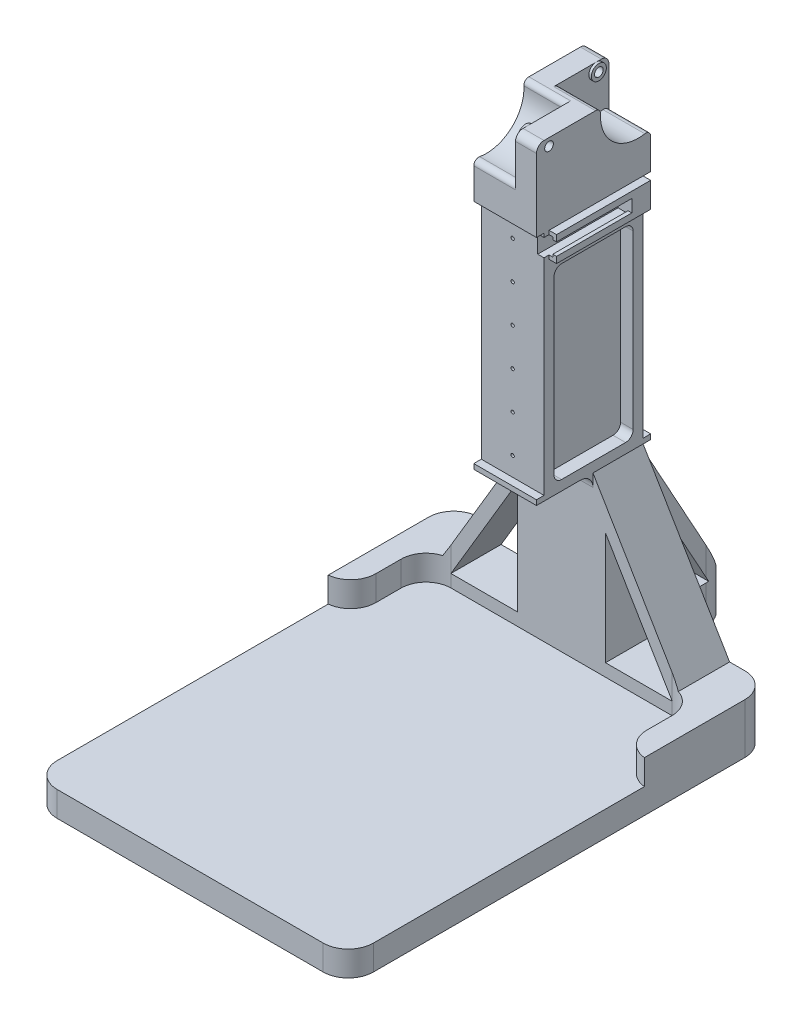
SolidWorks part; units mm, degrees
ref_plane "Front" through (0, 0, 0) normal (0, 0, 1) x (1, 0, 0)
ref_plane "Top" through (0, 0, 0) normal (0, 1, 0) x (1, 0, 0)
ref_plane "Right" through (0, 0, 0) normal (1, 0, 0) x (0, 0, -1)
sketch "Sketch1" plane through (0, 0, 0) normal (1, 0, 0) x (0, 0, -1)
  line L0 (0, 0) -> (0, -10)
  line L1 (0, -10) -> (67.49, -10)
  line L2 (67.49, -10) -> (67.49, 160.5)
  line L3 (67.49, 160.5) -> (27.987, 160.5)
  line L4 (27.987, 160.5) -> (27.987, 70)
  line L5 (27.987, 70) -> (47.49, 70)
  line L6 (47.49, 70) -> (47.49, 0)
  line L7 (47.49, 0) -> (0, 0)
  line L8 (50, 0) -> (-50, 0) construction
  line L9 (0, 50) -> (0, -50) construction
  dimension "D1" = 10
  dimension "D3" = 27.987
  dimension "D4" = 70
  dimension "D5" = 90.5
  dimension "D6" = 67.49
  dimension "D7" = 20
extrude "Boss-Extrude1" add sketch "Sketch1" along normal mid plane 25
hole_wizard "#55 (0.052) Diameter Hole1" positions "Sketch2" profile "Sketch3" hole size "#55" standard "ANSI Inch"
sketch "Sketch2" plane through (0, 0, -27.987) normal (0, 0, 1) x (1, 0, 0)
  line L0 (0, 77.5) -> (0, 92.5) construction
  line L1 (0, 92.5) -> (0, 107.5) construction
  line L2 (0, 107.5) -> (0, 122.5) construction
  line L4 (0, -50) -> (0, 50) construction
  line L5 (12.5, 70) -> (-12.5, 70) construction
  point P0 (0, 77.5)
  point P2 (0, 92.5)
  point P4 (0, 107.5)
  point P6 (0, 122.5)
  point P20 (0, 137.5)
  point P21 (0, 152.5)
  dimension "D1" = 15
  dimension "D2" = 7.5
  dimension "D3" = 15
  dimension "D4" = 15
sketch "Sketch3" plane through (0, 77.5, -27.987) normal (1, 0, 0) x (0, -1, 0)
  line L0 (0, 0) -> (0, 10.3968)
  line L1 (0, 10.3968) -> (0.6604, 10)
  line L2 (0.6604, 10) -> (0.6604, 0)
  line L5 (0.6604, 0) -> (0, 0)
  line L10 (0, 10.3968) -> (-0.6604, 10) construction
  line L11 (0, -6.35) -> (0, 107.95) construction
  dimension "Hole Dia." = 1.3208
  dimension "Hole Depth" = 10
  dimension "Drill Angle" = 118
sketch "Sketch4" plane through (0, 0, 0) normal (0, 1, 0) x (1, 0, 0)
  line L0 (12.5, 67.49) -> (-12.5, 67.49) construction
  line L1 (-53, 67.4905) -> (53, 67.4905)
  line L2 (-63, 57.4905) -> (-63, -90.5095)
  line L3 (-53, -100.5095) -> (53, -100.5095)
  line L4 (63, 57.4905) -> (63, -90.5095)
  arc A0 (-63, -90.5095) -> (-53, -100.5095) centre (-53, -90.5095) ccw
  arc A1 (53, -100.5095) -> (63, -90.5095) centre (53, -90.5095) ccw
  arc A2 (53, 67.4905) -> (63, 57.4905) centre (53, 57.4905) cw
  arc A3 (-53, 67.4905) -> (-63, 57.4905) centre (-53, 57.4905) ccw
  point P3 (0, 67.49)
  point P11 (63, -100.5095)
  point P14 (63, 67.4905)
  point P17 (-63, 67.4905)
  dimension "D1" = 126
  dimension "D4" = 10
  dimension "D2" = 168
  dimension "D3" = 63
extrude "Boss-Extrude4" add sketch "Sketch4" against normal up to surface (10 mm away)
sketch "Sketch5" plane through (0, 70, 0) normal (0, -1, 0) x (1, 0, 0)
  line L0 (0, -50) -> (0, 50) construction
  line L1 (-12.5, -47.49) -> (12.5, -47.49)
  line L2 (-12.5, -47.49) -> (-12.5, -24.987)
  line L3 (-12.5, -24.987) -> (12.5, -24.987)
  line L4 (12.5, -47.49) -> (12.5, -24.987)
  line L5 (-12.5, -47.49) -> (12.5, -24.987) construction
  line L6 (-12.5, -24.987) -> (12.5, -47.49) construction
  line L7 (12.5, -27.987) -> (12.5, -47.49) construction
  line L8 (12.5, -47.49) -> (-12.5, -47.49) construction
  line L9 (12.5, -27.987) -> (-12.5, -27.987) construction
  point P0 (0, -36.2385)
  dimension "D1" = 3
extrude "Boss-Extrude5" add sketch "Sketch5" along normal blind 2
sketch "Sketch6" plane through (0, 160.5, 0) normal (0, 1, 0) x (1, 0, 0)
  line L0 (12.5, 67.49) -> (-12.5, 67.49) construction
  line L4 (12.5, 47.49) -> (-12.5, 47.49)
  line L5 (12.5, 24.987) -> (12.5, 47.49)
  line L6 (-12.5, 24.987) -> (12.5, 24.987)
  line L7 (-12.5, 47.49) -> (-12.5, 24.987)
  line L8 (12.5, 67.49) -> (-12.5, 67.49)
  line L9 (12.5, 24.987) -> (12.5, 67.49)
  line L10 (-12.5, 24.987) -> (12.5, 24.987)
  line L11 (-12.5, 67.49) -> (-12.5, 24.987)
  dimension "D1" = 0
extrude "Boss-Extrude6" add sketch "Sketch6" along normal blind 2
fillet "Fillet1" radius 5 1 edges at (0, 68, -47.49)
sketch "Sketch7" plane through (12.5, 0, 0) normal (1, 0, 0) x (0, 0, -1)
  line L0 (67.49, 0) -> (67.49, 162.5) construction
  line L1 (27.987, 160.5) -> (67.49, 160.5)
  line L2 (27.987, 160.5) -> (27.987, 150.5)
  line L3 (27.987, 150.5) -> (67.49, 150.5)
  line L4 (67.49, 160.5) -> (67.49, 150.5)
  line L5 (27.987, 160.5) -> (27.987, 70) construction
  line L6 (24.987, 162.5) -> (67.49, 162.5) construction
  dimension "D1" = 2
  dimension "D2" = 10
extrude "Boss-Extrude7" add sketch "Sketch7" along normal blind 3
sketch "Sketch8" plane through (0, 0, -27.987) normal (0, 0, 1) x (1, 0, 0)
  line L0 (15.5, 158) -> (14, 158)
  line L1 (14, 158) -> (14, 159)
  line L5 (14, 152) -> (14, 153)
  line L6 (14, 153) -> (15.5, 153)
  line L7 (15.5, 153) -> (15.5, 158)
  line L8 (12.5, 155.5) -> (15.5, 155.5) construction
  line L9 (15.5, 160.5) -> (15.5, 150.5) construction
  line L12 (14, 158) -> (14, 153) construction
  line L13 (14, 159) -> (10, 159)
  line L14 (10, 159) -> (10, 152)
  line L15 (10, 152) -> (14, 152)
  point P14 (15.5, 155.5)
  dimension "D1" = 1.5
  dimension "D2" = 4
  dimension "D3" = 5
sketch "Sketch9" plane through (0, 0, -67.49) normal (0, 0, -1) x (-1, 0, 0)
  line L0 (12.5, 0) -> (12.5, 162.5) construction
  line L1 (-12.5, 162.5) -> (12.5, 162.5)
  line L2 (-12.5, 162.5) -> (-12.5, 160.5)
  line L3 (-12.5, 160.5) -> (12.5, 160.5)
  line L4 (12.5, 162.5) -> (12.5, 160.5)
  line L5 (-15.5, 160.5) -> (-12.5, 160.5) construction
extrude "Boss-Extrude8" add sketch "Sketch9" along normal blind 3
sketch "Sketch10" plane through (0, 0, -67.49) normal (0, 0, -1) x (-1, 0, 0)
  line L0 (-12.5, 0) -> (-12.5, 150.5) construction
  line L1 (-12.5, 70) -> (12.5, 70)
  line L2 (-12.5, 70) -> (-12.5, 68)
  line L3 (-12.5, 68) -> (12.5, 68)
  line L4 (12.5, 70) -> (12.5, 68)
  line L5 (12.5, 0) -> (12.5, 160.5) construction
  line L7 (-12.5, 160.5) -> (12.5, 160.5) construction
  dimension "D1" = 2
  dimension "D2" = 90.5
extrude "Boss-Extrude9" add sketch "Sketch10" along normal blind 3
sketch "Sketch11" plane through (0, 0, -67.49) normal (0, 0, -1) x (-1, 0, 0)
  line L0 (12.5, 70) -> (-12.5, 70) construction
  point P0 (0, 77.5)
  point P1 (0, 92.5)
  point P2 (0, 107.5)
  point P3 (0, 122.5)
  point P4 (0, 137.5)
  point P5 (0, 152.5)
  dimension "D1" = 7.5
  dimension "D2" = 15
  dimension "D3" = 15
  dimension "D4" = 15
  dimension "D5" = 15
  dimension "D6" = 15
hole_wizard "#55 (0.052) Diameter Hole2" positions "Sketch12" profile "Sketch13" hole size "#55" standard "ANSI Inch"
sketch "Sketch12" plane through (0, 0, -67.49) normal (0, 0, -1) x (-1, 0, 0)
  point P0 (0, 77.5)
  point P3 (0, 92.5)
  point P6 (0, 107.5)
  point P9 (0, 122.5)
  point P12 (0, 137.5)
  point P15 (0, 152.5)
sketch "Sketch13" plane through (0, 77.5, -67.49) normal (1, 0, 0) x (0, 1, 0)
  line L0 (0, 0) -> (0, 10.3968)
  line L1 (0, 10.3968) -> (0.6604, 10)
  line L2 (0.6604, 10) -> (0.6604, 0)
  line L5 (0.6604, 0) -> (0, 0)
  line L10 (0, 10.3968) -> (-0.6604, 10) construction
  line L11 (0, -6.35) -> (0, 107.95) construction
  dimension "Hole Dia." = 1.3208
  dimension "Hole Depth" = 10
  dimension "Drill Angle" = 118
sketch "Sketch19" plane through (0, 0, -67.49) normal (0, 0, -1) x (-1, 0, 0)
  line L0 (-12.5, 68) -> (-52.9003, 0)
  line L1 (-52.9003, 0) -> (-12.5, 0)
  line L2 (-12.5, 0) -> (12.5, 0) construction
  line L3 (-12.5, 0) -> (-12.5, 68)
  line L4 (0, 68) -> (0, 0) construction
  line L5 (52.9003, 0) -> (12.5, 0)
  line L6 (12.5, 68) -> (52.9003, 0)
  line L7 (12.5, 0) -> (12.5, 68)
extrude "Extrude-Thin1" add sketch "Sketch19" against normal blind 20 thin
sketch "Sketch20" plane through (0, 0, -67.49) normal (0, 0, -1) x (-1, 0, 0)
  line L0 (-12.5, 68) -> (12.5, 68) construction
  line L1 (-10, 68) -> (10, 68)
  line L2 (-10, 68) -> (-10, 0)
  line L4 (10, 68) -> (10, 0)
  line L6 (-10, 0) -> (10, 0)
  line L7 (-52.9003, 0) -> (52.9003, 0) construction
  dimension "D1" = 20
  dimension "D2" = 2.5
extrude "Boss-Extrude11" add sketch "Sketch20" along normal blind 43
sketch "Sketch22" plane through (10, 0, 0) normal (1, 0, 0) x (0, 0, -1)
  line L1 (67.49, 68) -> (104.9772, 0)
  line L4 (104.9772, 68) -> (67.49, 68)
  line L6 (110.49, 0) -> (67.4905, 0) construction
  line L7 (104.9772, 68) -> (110.49, 68)
  line L8 (110.49, 68) -> (110.49, 0) construction
  line L9 (110.49, 68) -> (70.49, 68) construction
  line L10 (110.49, 68) -> (110.49, 0)
  line L11 (110.49, 0) -> (104.9772, 0)
extrude "Cut-Extrude4" cut sketch "Sketch22" against normal blind 43
sketch "Sketch24" plane through (10, 0, 0) normal (1, 0, 0) x (0, 0, -1)
  line L0 (72.49, 47.9007) -> (72.49, 0)
  line L2 (98.8968, 0) -> (72.49, 47.9007)
  line L3 (67.49, 68) -> (104.9772, 0) construction
  line L4 (67.49, 68) -> (67.49, 0) construction
  line L6 (72.49, 0) -> (98.8968, 0)
  line L7 (104.9772, 0) -> (67.4905, 0) construction
  dimension "D1" = 0
  dimension "D2" = 5
extrude "Cut-Extrude5" cut sketch "Sketch24" against normal blind 43
sketch "Sketch25" plane through (0, 0, 0) normal (0, 1, 0) x (1, 0, 0)
  line L1 (-54, 17.49) -> (-63, 17.49)
  line L2 (-63, 57.4905) -> (-63, -90.5095) construction
  line L3 (-63, 17.49) -> (-63, 57.4905)
  line L4 (-52.9003, 67.49) -> (-44.1138, 67.49)
  line L5 (-44.1138, 67.49) -> (-44.1138, 47.49)
  line L6 (52.9003, 47.49) -> (-52.9003, 47.49) construction
  line L9 (54, 17.49) -> (63, 17.49)
  line L10 (63, -90.5095) -> (63, 57.4905) construction
  line L11 (63, 17.49) -> (63, 57.4905)
  line L12 (52.9003, 67.49) -> (44.003, 67.49)
  line L13 (52.9003, 67.49) -> (10, 67.49) construction
  line L14 (44.003, 67.49) -> (44.003, 47.49)
  line L16 (54, 17.49) -> (54, 47.49)
  line L18 (54, 47.49) -> (44.003, 47.49)
  line L20 (-54, 47.49) -> (-54, 17.49)
  line L21 (-54, 47.49) -> (-44.1138, 47.49)
  arc A0 (-52.9003, 67.49) -> (-63, 57.4905) centre (-53, 57.4905) ccw
  arc A2 (63, 57.4905) -> (52.9003, 67.49) centre (53, 57.4905) ccw
  dimension "D1" = 9
  dimension "D2" = 9
sketch "Sketch12" plane through (0, 0, -67.4905) normal (0, 0, -1) x (-1, 0, 0)
  line L0 (53, -10) -> (-53, -10) construction
  line L1 (-10, 0) -> (10, 0)
  line L2 (-10, 0) -> (-10, -10)
  line L3 (-10, -10) -> (10, -10)
  line L4 (10, 0) -> (10, -10)
  line L5 (10, 0) -> (10, 68) construction
extrude "Boss-Extrude13" add sketch "Sketch12" along normal blind 37.5
sketch "Sketch13" plane through (0, 0, -72.49) normal (0, 0, -1) x (-1, 0, 0)
  line L0 (10, 47.9007) -> (10, 0) construction
  line L1 (-10, 0) -> (10, 0)
  line L2 (-10, 0) -> (-10, 5)
  line L3 (-10, 5) -> (10, 5)
  line L4 (10, 0) -> (10, 5)
  line L5 (-44.1138, 5) -> (-17.5, 5) construction
extrude "Boss-Extrude14" add sketch "Sketch13" along normal up to next
fillet "Fillet4" radius 10 2 edges at (10, -5, -104.9905) (-10, -5, -104.9905)
sketch "Sketch28" plane through (0, 162.5, 0) normal (0, 1, 0) x (1, 0, 0)
  line L0 (12.5, 24.987) -> (12.5, 70.49) construction
  line L2 (12.5, 27.987) -> (12.5, 67.49)
  line L4 (-12.5, 27.987) -> (-12.5, 67.49)
  line L5 (15.5, 27.987) -> (12.5, 27.987) construction
  line L6 (-52.9003, 67.49) -> (-12.5, 67.49) construction
  line L7 (-12.5, 70.49) -> (-12.5, 24.987) construction
  line L8 (-12.5, 24.987) -> (12.5, 24.987)
  line L9 (12.5, 24.987) -> (12.5, 27.987)
  line L10 (-12.5, 24.987) -> (-12.5, 27.987)
  line L11 (-12.5, 67.49) -> (-12.5, 70.49)
  line L12 (-12.5, 70.49) -> (12.5, 70.49)
  line L13 (12.5, 70.49) -> (12.5, 67.49)
extrude "Boss-Extrude15" add sketch "Sketch28" along normal blind 30
sketch "Sketch36" plane through (12.5, 0, 0) normal (1, 0, 0) x (0, 0, -1)
  line L0 (24.987, 192.5) -> (70.49, 192.5) construction
  line L1 (70.49, 192.5) -> (70.49, 160.5) construction
  circle A0 centre (65.49, 189.5) radius 15
  dimension "D1" = 30
  dimension "D2" = 3
  dimension "D3" = 5
extrude "Cut-Extrude8" cut sketch "Sketch36" against normal blind 16.65
sketch "Sketch37" plane through (-12.5, 0, 0) normal (-1, 0, 0) x (0, 0, 1)
  line L0 (-24.987, 192.5) -> (-24.987, 160.5) construction
  line L1 (-70.49, 192.5) -> (-24.987, 192.5) construction
  circle A0 centre (-29.987, 189.5) radius 15
  dimension "D1" = 30
  dimension "D2" = 5
  dimension "D3" = 3
extrude "Cut-Extrude9" cut sketch "Sketch37" against normal blind 16.65
sketch "Sketch38" plane through (4.15, 0, 0) normal (-1, 0, 0) x (0, 0, 1)
  line L1 (-44.6839, 192.5) -> (-24.987, 192.5) construction
  line L2 (-24.987, 175.3579) -> (-24.987, 192.5) construction
  point P0 (-29.987, 189.5)
  dimension "D1" = 5
  dimension "D2" = 3
hole_wizard "#8-36 Tapped Hole1" positions "Sketch39" profile "Sketch40" tap size "#8-36" standard "ANSI Inch"
sketch "Sketch39" plane through (4.15, 0, 0) normal (-1, 0, 0) x (0, 0, 1)
  point P0 (-29.987, 189.5)
sketch "Sketch40" plane through (4.15, 189.5, -29.987) normal (0, 1, 0) x (0, 0, 1)
  line L0 (0, 0) -> (0, 8.35)
  line L1 (0, 8.35) -> (1.7272, 8.35)
  line L2 (1.7272, 8.35) -> (1.7272, 0)
  line L5 (1.7272, 0) -> (0, 0)
  line L11 (0, -6.35) -> (0, 107.95) construction
  dimension "Thru Tap Drill Dia." = 3.4544
  dimension "Thru Tap Drill Depth" = 8.35
sketch "Sketch41" plane through (-4.15, 0, 0) normal (1, 0, 0) x (0, 0, -1)
  line L0 (50.7931, 192.5) -> (70.49, 192.5) construction
  line L2 (70.49, 192.5) -> (70.49, 175.3579) construction
  point P0 (65.49, 189.5)
  dimension "D1" = 3
  dimension "D2" = 5
hole_wizard "#8-32 Tapped Hole1" positions "Sketch44" profile "Sketch43" tap size "#8-32" standard "ANSI Inch"
sketch "Sketch44" plane through (-4.15, 0, 0) normal (1, 0, 0) x (0, 0, -1)
  point P0 (65.49, 189.5)
sketch "Sketch43" plane through (-4.15, 189.5, -65.49) normal (0, 1, 0) x (0, 0, -1)
  line L0 (0, 0) -> (0, 8.35)
  line L1 (0, 8.35) -> (1.7272, 8.35)
  line L2 (1.7272, 8.35) -> (1.7272, 0)
  line L5 (1.7272, 0) -> (0, 0)
  line L11 (0, -6.35) -> (0, 107.95) construction
  dimension "Thru Tap Drill Dia." = 3.4544
  dimension "Thru Tap Drill Depth" = 8.35
fillet "Fillet6" radius 3 2 edges at (-8.325, 192.5, -70.49) (8.325, 192.5, -24.987)
extrude "Cut-Extrude10" cut sketch "Sketch8" against normal blind 32
extrude "Boss-Extrude16" add sketch "Sketch25" along normal blind 10
fillet "Fillet8" radius 10 4 edges at (54, 5, -17.49) (54, 5, -47.49) (-54, 5, -17.49) (-54, 5, -47.49)
sketch "Sketch45" plane through (0, 160.5, 0) normal (0, 1, 0) x (1, 0, 0)
  line L0 (15.5, 67.49) -> (15.5, 27.987) construction
  line L1 (12.5, 27.987) -> (15.5, 27.987)
  line L2 (12.5, 27.987) -> (12.5, 29.987)
  line L3 (12.5, 29.987) -> (15.5, 29.987)
  line L4 (15.5, 27.987) -> (15.5, 29.987)
  dimension "D1" = 2
extrude "Cut-Extrude11" cut sketch "Sketch45" against normal up to surface (10 mm away)
sketch "Sketch46" plane through (-4.15, 0, 0) normal (1, 0, 0) x (0, 0, -1)
  circle A0 centre (65.49, 189.5) radius 3
  circle A1 centre (65.49, 189.5) radius 1.7272
  dimension "D1" = 6
fillet "Fillet10" radius 2 4 edges at (-4.175, 192.5, -44.6839) (-4.175, 175.3579, -24.987) (4.175, 192.5, -50.7931) (4.175, 175.3579, -70.49)
sketch "Sketch47" plane through (4.15, 0, 0) normal (-1, 0, 0) x (0, 0, 1)
  circle A0 centre (-29.987, 189.5) radius 3
  circle A1 centre (-29.987, 189.5) radius 1.7272
  dimension "D1" = 6
extrude "Boss-Extrude18" add sketch "Sketch47" along normal blind 1
sketch "Sketch48" plane through (-4.15, 0, 0) normal (1, 0, 0) x (0, 0, -1)
  circle A0 centre (65.49, 189.5) radius 1.7272
  circle A1 centre (65.49, 189.5) radius 2.38
  dimension "D1" = 4.76
extrude "Boss-Extrude19" add sketch "Sketch48" along normal blind 1
extrude "Boss-Extrude17" add sketch "Sketch46" along normal blind 1
sketch "Sketch49" plane through (12.5, 0, 0) normal (1, 0, 0) x (0, 0, -1)
  line L0 (29.987, 150.5) -> (67.49, 150.5) construction
  line L1 (31.987, 146.5) -> (63.49, 146.5)
  line L2 (31.987, 146.5) -> (31.987, 72)
  line L3 (31.987, 72) -> (63.49, 72)
  line L4 (63.49, 146.5) -> (63.49, 72)
  line L5 (47.49, 68) -> (67.49, 68) construction
  line L6 (67.49, 70) -> (67.49, 150.5) construction
  line L7 (27.987, 152) -> (27.987, 70) construction
  dimension "D1" = 4
  dimension "D2" = 4
  dimension "D3" = 4
  dimension "D4" = 4
extrude "Cut-Extrude12" cut sketch "Sketch49" against normal blind 5
mirror "Mirror1" about plane through (0, 0, 0) normal (1, 0, 0) of "Cut-Extrude12"
fillet "Fillet11" radius 3 8 edges at (-10, 146.5, -31.987) (-10, 146.5, -63.49) (-10, 72, -31.987) (-10, 72, -63.49) (10, 72, -31.987) (10, 72, -63.49) (10, 146.5, -63.49) (10, 146.5, -31.987)
